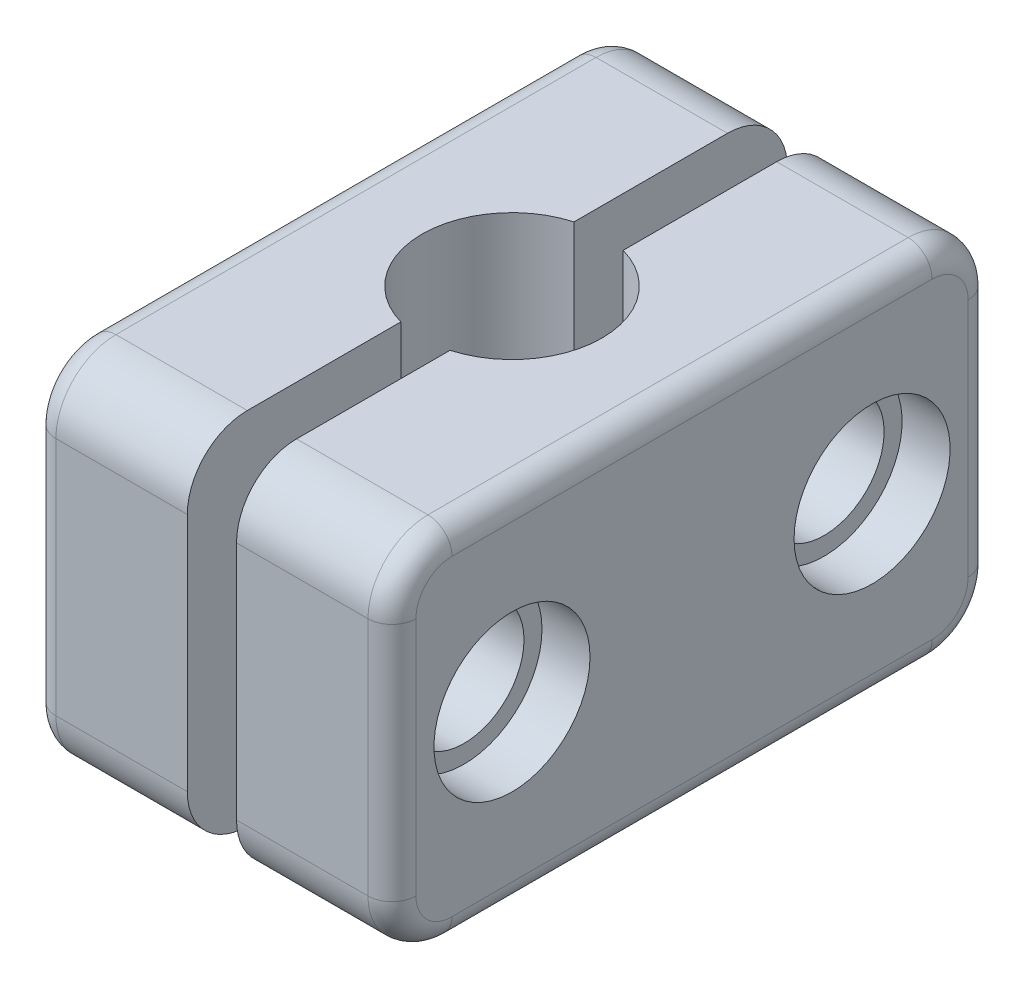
SolidWorks part; units mm, degrees
ref_plane "Front Plane" through (0, 0, 0) normal (0, 0, 1) x (1, 0, 0)
ref_plane "Top Plane" through (0, 0, 0) normal (0, 1, 0) x (1, 0, 0)
ref_plane "Right Plane" through (0, 0, 0) normal (1, 0, 0) x (0, 0, -1)
sketch "Sketch1" plane through (0, 0, 0) normal (1, 0, 0) x (0, 0, -1)
  line L0 (-25, 0) -> (25, 0) construction
  line L1 (-20, 15) -> (20, 15)
  line L2 (-25, 10) -> (-25, -10)
  line L3 (-20, -15) -> (20, -15)
  line L4 (25, 10) -> (25, -10)
  line L5 (-25, 15) -> (25, -15) construction
  line L6 (-25, -15) -> (25, 15) construction
  line L7 (0, 0) -> (0, -12.2343) construction
  arc A0 (20, 15) -> (25, 10) centre (20, 10) cw
  arc A1 (20, -15) -> (25, -10) centre (20, -10) ccw
  arc A2 (-25, -10) -> (-20, -15) centre (-20, -10) ccw
  arc A3 (-20, 15) -> (-25, 10) centre (-20, 10) ccw
  circle A4 centre (-15, 0) radius 5
  circle A5 centre (15, 0) radius 5
  point P0 (0, 0)
  dimension "D3" = 5
  dimension "D4" = 10
  dimension "D5" = 15
  dimension "D1" = 50
  dimension "D2" = 30
extrude "Boss-Extrude1" add sketch "Sketch1" along normal mid plane 30
fillet "Fillet1" radius 2 16 edges at (-15, 13.5355, -23.5355) (-15, 0, -25) (-15, -13.5355, -23.5355) (-15, -15, 0) (-15, -13.5355, 23.5355) (-15, 0, 25) (-15, 13.5355, 23.5355) (15, 13.5355, -23.5355) (15, 0, -25) (15, -13.5355, -23.5355) (15, -15, 0) (15, -13.5355, 23.5355) (15, 0, 25) (15, 13.5355, 23.5355) (-15, 15, 0) (15, 15, 0)
sketch "Sketch2" plane through (15, 0, 0) normal (1, 0, 0) x (0, 0, -1)
  line L0 (0, 0) -> (0, 58.385) construction
  circle A0 centre (-15, 0) radius 6.5
  circle A1 centre (15, 0) radius 6.5
  dimension "D1" = 13
extrude "Cut-Extrude1" cut sketch "Sketch2" against normal blind 4
mirror "Mirror1" about plane through (0, 0, 0) normal (1, 0, 0) of "Cut-Extrude1"
sketch "Sketch3" plane through (0, 15, 0) normal (0, 1, 0) x (1, 0, 0)
  line L0 (-2.05, -7.2144) -> (-2.05, -38.0519)
  line L1 (-2.05, 38.0519) -> (2.05, 38.0519)
  line L2 (-2.05, 38.0519) -> (-2.05, 7.2144)
  line L3 (-2.05, -38.0519) -> (2.05, -38.0519)
  line L4 (2.05, 38.0519) -> (2.05, 7.2144)
  line L5 (-2.05, 38.0519) -> (2.05, -38.0519) construction
  line L6 (-2.05, -38.0519) -> (2.05, 38.0519) construction
  line L7 (2.05, -7.2144) -> (2.05, -38.0519)
  arc A0 (-2.05, 7.2144) -> (-2.05, -7.2144) centre (0, 0) ccw
  arc A1 (2.05, -7.2144) -> (2.05, 7.2144) centre (0, 0) ccw
  dimension "D1" = 15
  dimension "D2" = 4.1
extrude "Cut-Extrude4" cut sketch "Sketch3" against normal blind 80
